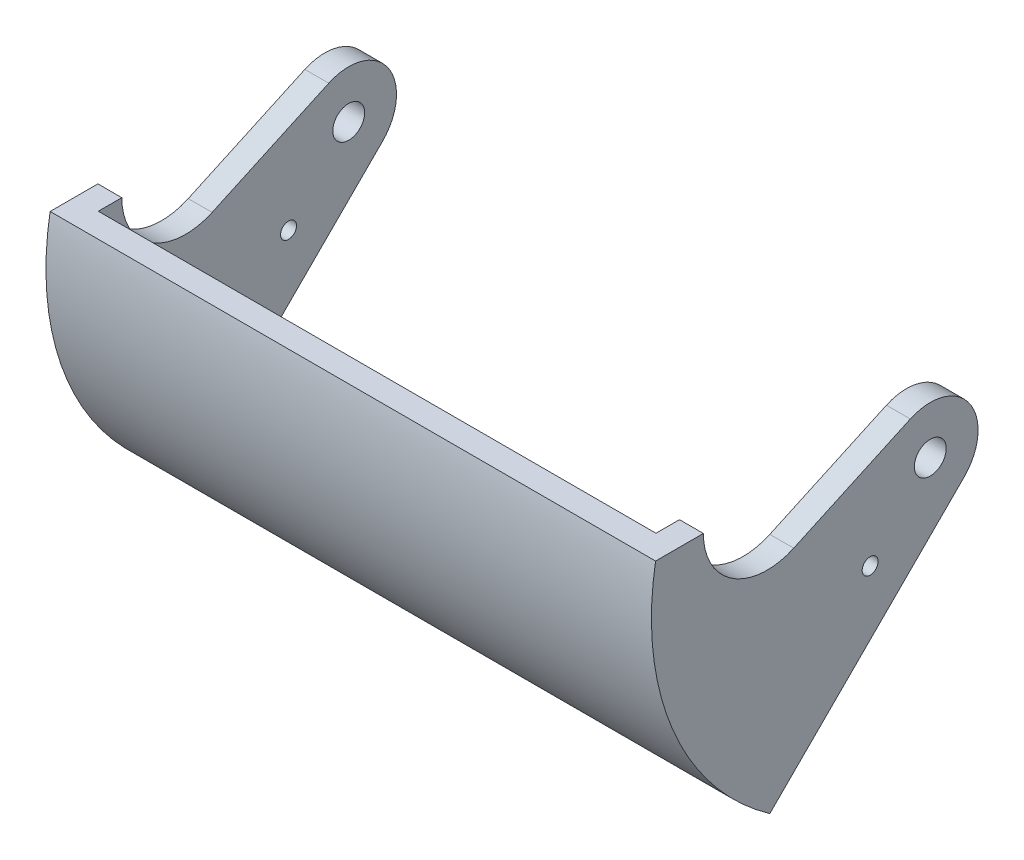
SolidWorks part; units mm, degrees
ref_plane "Plan de face" through (0, 0, 0) normal (0, 0, 1) x (1, 0, 0)
ref_plane "Plan de dessus" through (0, 0, 0) normal (0, 1, 0) x (1, 0, 0)
ref_plane "Plan de droite" through (0, 0, 0) normal (1, 0, 0) x (0, 0, -1)
sketch "Esquisse1" plane through (0, 0, 0) normal (1, 0, 0) x (0, 0, -1)
  line L0 (0, 12.0497) -> (0, -32.8411) construction
  line L1 (7.7684, 0) -> (-35.9222, 0) construction
  line L2 (-34.4819, 6) -> (-28.4819, 6)
  line L3 (4.2426, -4.2426) -> (-20.1397, -28.625)
  line L4 (-17.1433, -1.2701) -> (-2.5039, 5.4526)
  line L5 (-7.5498, -1.5184) -> (-7.5498, -11.4808) construction
  line L6 (-13.1719, -8) -> (-3.2095, -8) construction
  line L7 (0, 0) -> (-7.5498, -8) construction
  arc A0 (-34.4819, 6) -> (-20.1397, -28.625) centre (0, 0) ccw
  circle A1 centre (0, 0) radius 2
  arc A2 (4.2426, -4.2426) -> (-2.5039, 5.4526) centre (0, 0) ccw
  arc A3 (-28.4819, 6) -> (-17.1433, -1.2701) centre (-20.4819, 6) ccw
  circle A4 centre (-7.5498, -8) radius 1
  dimension "D2" = 4
  dimension "D3" = 70
  dimension "D4" = 16
  dimension "D7" = 2
  dimension "D1" = 6
  dimension "D5" = 6
  dimension "D6" = 45
  dimension "D8" = 11
  dimension "D9" = 8
extrude "Base extrudée" add sketch "Esquisse1" along normal mid plane 76
sketch "Esquisse2" plane through (0, 0, 0) normal (1, 0, 0) x (0, 0, -1)
  line L0 (4.2426, -4.2426) -> (-20.1397, -28.625) construction
  line L1 (-34.4819, 6) -> (-28.4819, 6) construction
  line L2 (-17.1433, -1.2701) -> (-2.5039, 5.4526) construction
  line L3 (4.2426, -4.2426) -> (-17.9835, -26.4688)
  line L4 (-31.4325, 6) -> (-28.4819, 6)
  line L5 (-17.1433, -1.2701) -> (-2.5039, 5.4526)
  arc A0 (-28.4819, 6) -> (-17.1433, -1.2701) centre (-20.4819, 6) ccw construction
  arc A1 (4.2426, -4.2426) -> (-2.5039, 5.4526) centre (0, 0) ccw construction
  arc A2 (-28.4819, 6) -> (-17.1433, -1.2701) centre (-20.4819, 6) ccw
  arc A3 (4.2426, -4.2426) -> (-2.5039, 5.4526) centre (0, 0) ccw
  arc A9 (-31.5263, 5.4857) -> (-18.4135, -26.1714) centre (0, 0) ccw
  arc A10 (-31.4325, 6) -> (-17.9835, -26.4688) centre (0, 0) ccw
  dimension "D1" = 3
extrude "Evidement" cut sketch "Esquisse2" against normal mid plane 70
sketch "Centre de gravité" plane through (0, 0, 0) normal (1, 0, 0) x (0, 0, -1)
  point P0 (-24.69, -10.86)
  dimension "D1" = 10.86
  dimension "D2" = 24.69
